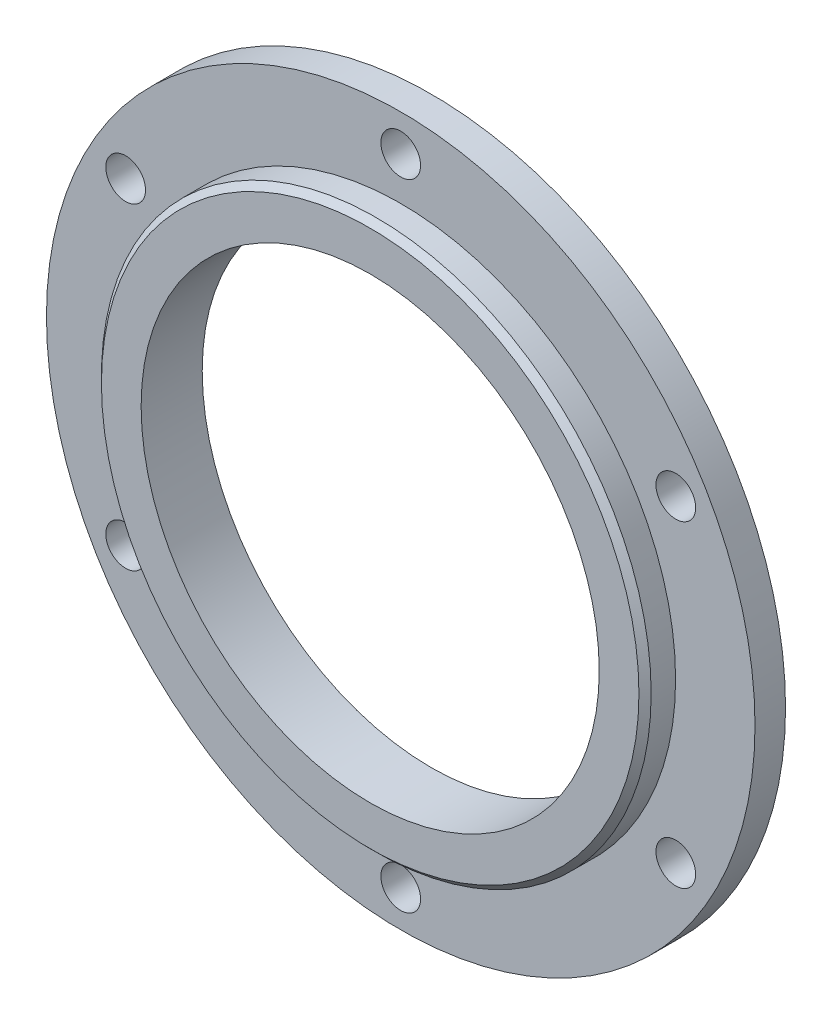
SolidWorks part; units mm, degrees
ref_plane "Plan de face" through (0, 0, 0) normal (0, 0, 1) x (1, 0, 0)
ref_plane "Plan de dessus" through (0, 0, 0) normal (0, 1, 0) x (1, 0, 0)
ref_plane "Plan de droite" through (0, 0, 0) normal (1, 0, 0) x (0, 0, -1)
sketch "Esquisse2" plane through (0, 0, 0) normal (1, 0, 0) x (0, 0, -1)
  line L0 (0, 0) -> (74.4486, 0) construction
  line L1 (1, 45) -> (5, 45)
  line L2 (5, 45) -> (5, 58)
  line L3 (5, 58) -> (10, 58)
  line L4 (10, 58) -> (10, 37.5)
  line L5 (10, 37.5) -> (0, 37.5)
  line L6 (0, 37.5) -> (0, 44)
  line L7 (0, 44) -> (1, 45)
  point P3 (0, 45)
  dimension "D1" = 75
  dimension "D2" = 90
  dimension "D3" = 10
  dimension "D4" = 5
  dimension "D5" = 116
  dimension "D6" = 1
  dimension "D7" = 45
revolve "Révolution1" add sketch "Esquisse2" angle 360 about L0
sketch "Esquisse3" plane through (0, 0, -5) normal (0, 0, 1) x (1, 0, 0)
  line L0 (0, -15.4073) -> (0, 65.7438) construction
  circle A0 centre (0, 52) radius 3.25
  circle A1 centre (0, 0) radius 52 construction
  circle A2 centre (45.0333, 26) radius 3.25
  circle A3 centre (45.0333, -26) radius 3.25
  circle A4 centre (0, -52) radius 3.25
  circle A5 centre (-45.0333, -26) radius 3.25
  circle A6 centre (-45.0333, 26) radius 3.25
  dimension "D1" = 6.5
  dimension "D2" = 104
extrude "Extrusion1" cut sketch "Esquisse3" against normal blind 10
